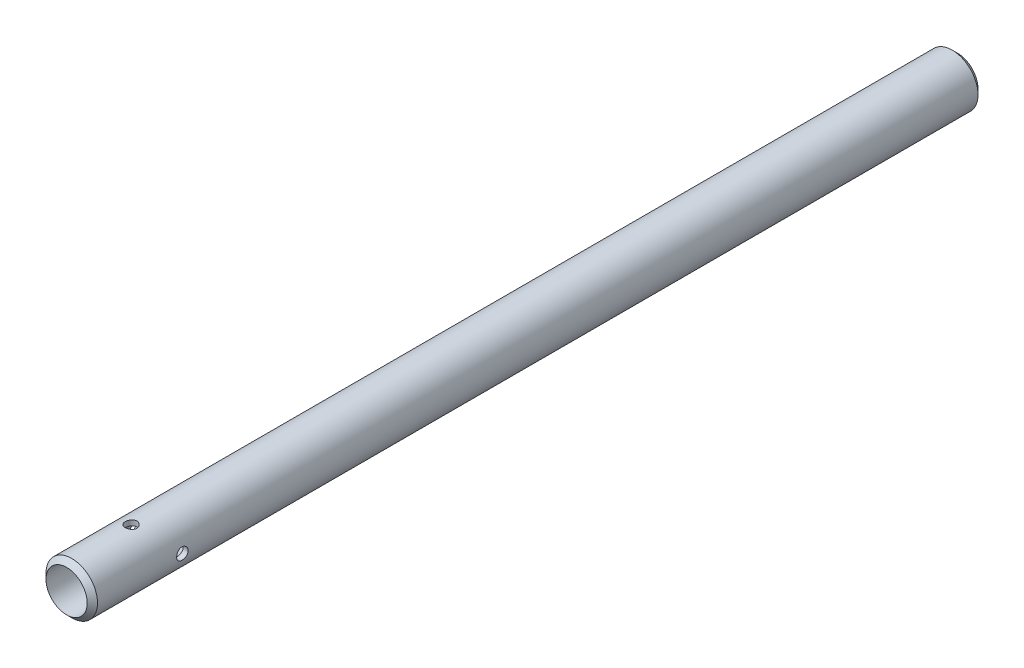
SolidWorks part; units mm, degrees
ref_plane "Plan1" through (0, 0, 0) normal (0, 0, 1) x (1, 0, 0)
ref_plane "Plan2" through (0, 0, 0) normal (0, 1, 0) x (1, 0, 0)
ref_plane "Plan3" through (0, 0, 0) normal (1, 0, 0) x (0, 0, -1)
sketch "Esquisse1" plane through (0, 0, 0) normal (0, 0, 1) x (1, 0, 0)
  circle A0 centre (0, 0) radius 10
  dimension "D1" = 20
extrude "Base-Extru.-Mince" add sketch "Esquisse1" along normal mid plane 346 thin
sketch "Esquisse2" plane through (0, 0, 0) normal (0, 1, 0) x (1, 0, 0)
  line L0 (0, -173) -> (0, 173) construction
  line L1 (-10, -173) -> (10, -173) construction
  circle A0 centre (0, -148) radius 2.25
  dimension "D1" = 4.5
  dimension "D2" = 25
extrude "Enlèv. mat.-Extru.1" cut sketch "Esquisse2" against normal through all and the other way through all
sketch "Esquisse3" plane through (0, 0, 0) normal (1, 0, 0) x (0, 0, -1)
  line L0 (-173, 0) -> (173, 0) construction
  line L1 (-148, -11.3643) -> (-148, -7.2714) construction
  circle A0 centre (-138, 0) radius 2.25
  dimension "D1" = 4.5
  dimension "D2" = 10
extrude "Enlèv. mat.-Extru.2" cut sketch "Esquisse3" against normal through all and the other way through all
chamfer "Chanfrein1" distance 2 angle 45
ref_plane "Plan4" through (0, 0, 173) normal (0, 0, 1) x (1, 0, 0)
ref_plane "Plan5" through (0, 0, -173) normal (0, 0, 1) x (1, 0, 0)
